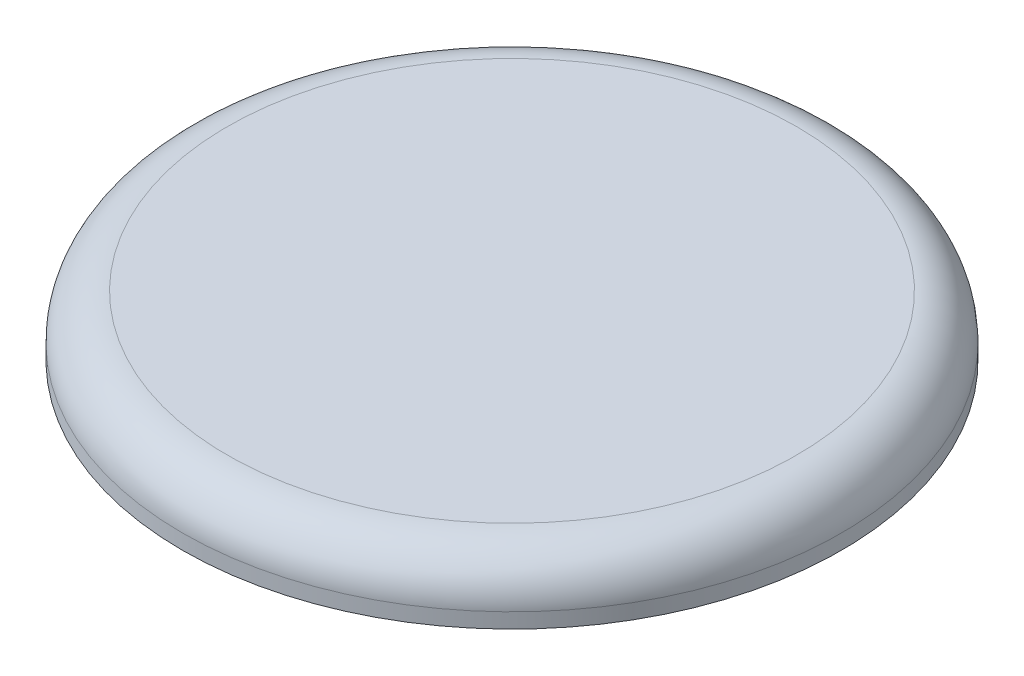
SolidWorks part; units mm, degrees
ref_plane "Plan de face" through (0, 0, 0) normal (0, 0, 1) x (1, 0, 0)
ref_plane "Plan de dessus" through (0, 0, 0) normal (0, 1, 0) x (1, 0, 0)
ref_plane "Plan de droite" through (0, 0, 0) normal (1, 0, 0) x (0, 0, -1)
sketch "Esquisse1" plane through (0, 0, 0) normal (0, 0, 1) x (1, 0, 0)
  line L0 (0, 28.9362) -> (0, 0) construction
  line L1 (0, 5.8) -> (11, 5.8)
  line L2 (11, 5.8) -> (11, 3.8)
  line L3 (11, 3.8) -> (5.5, 3.8)
  line L4 (5.5, 3.8) -> (5.5, 3.2)
  line L5 (5.5, 3.2) -> (4, 3.2)
  line L6 (4, 3.2) -> (4, 0)
  line L7 (4, 0) -> (0, 0)
  line L8 (0, 5.8) -> (0, 0)
  point P5 (5.5, 3.5)
  point P12 (4.75, 3.2)
  point P13 (0, 1.5697)
  point P14 (0, 0)
  dimension "D1" = 4
  dimension "D2" = 5.5
  dimension "D3" = 3.2
  dimension "D4" = 2
  dimension "D5" = 11
  dimension "D6" = 0.6
revolve "Révolution1" add sketch "Esquisse1" angle 360 about L0
fillet "Congé1" radius 1.5 1 edges at (0, 5.8, 11)
fillet "Congé2" radius 0.5 1 edges at (0, 0, 4)
sketch "Esquisse2" plane through (0, 5.8, 0) normal (0, 1, 0) x (1, 0, 0)
  line L0 (0, 0) -> (9.5, 0) construction
  line L1 (0, 0) -> (0, 9.5) construction
  circle A0 centre (0, 0) radius 9.5 construction
